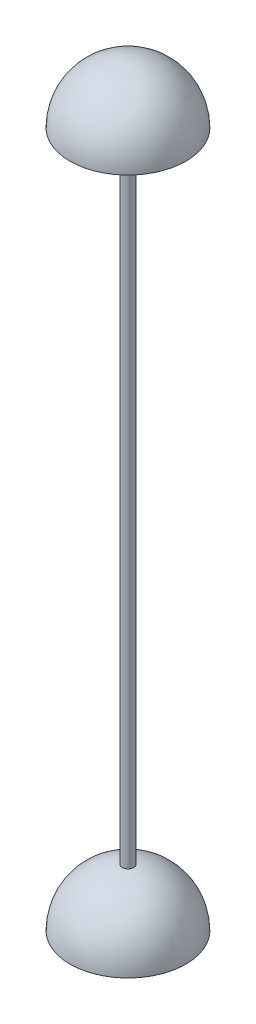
SolidWorks part; units mm, degrees
ref_plane "Alzado" through (0, 0, 0) normal (0, 0, 1) x (1, 0, 0)
ref_plane "Planta" through (0, 0, 0) normal (0, 1, 0) x (1, 0, 0)
ref_plane "Vista lateral" through (0, 0, 0) normal (1, 0, 0) x (0, 0, -1)
sketch "Croquis1" plane through (0, 0, 0) normal (0, 1, 0) x (1, 0, 0)
  line L1 (0, 100) -> (0, 80)
  line L2 (0, -80) -> (0, -100)
  line L3 (0, 100) -> (0, -100) construction
  arc A0 (0, -100) -> (0, 100) centre (0, 0) ccw
  arc A1 (0, -80) -> (0, 80) centre (0, 0) ccw
  point P6 (0, 0)
  dimension "D1" = 200
  dimension "D2" = 20
revolve "Revolución1" add sketch "Croquis1" angle 180 about L3
sketch "Croquis2" plane through (0, 0, 0) normal (0, -1, 0) x (1, 0, 0)
  circle A0 centre (0, 0) radius 80
extrude "Saliente-Extruir1" add sketch "Croquis2" against normal blind 5 separate body
split "Partir1" bodies to split 102 resulting bodies 103 104
delete or keep bodies "Sólido-Eliminar/Conservar 1" type delete bodies bodies 104
ref_plane "Plano3" through (0, 1400, 0) normal (0, 1, 0) x (1, 0, 0)
move or copy body "Sólido-Mover/Copiar2" bodies to move or copy 101 103 copy yes number of copies 1 translate (0, 1200, 0)
delete or keep bodies "Sólido-Eliminar/Conservar 2" type delete bodies bodies 103
sketch "Croquis7" plane through (0, 1200, 0) normal (0, -1, 0) x (1, 0, 0)
  circle A0 centre (0, 0) radius 10
  dimension "D1" = 20
extrude "Saliente-Extruir3" add sketch "Croquis7" along normal up to body separate body
